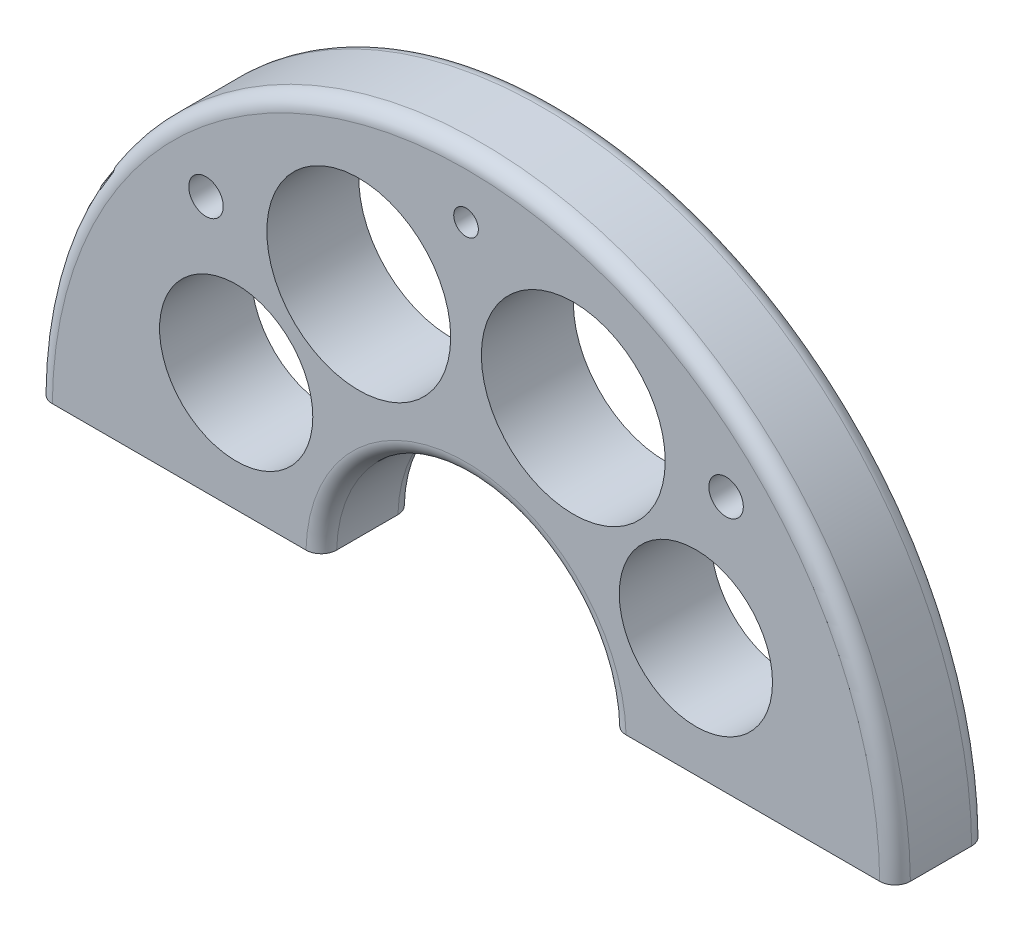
SolidWorks part; units mm, degrees
ref_plane "Front Plane" through (0, 0, 0) normal (0, 0, 1) x (1, 0, 0)
ref_plane "Top Plane" through (0, 0, 0) normal (0, 1, 0) x (1, 0, 0)
ref_plane "Right Plane" through (0, 0, 0) normal (1, 0, 0) x (0, 0, -1)
sketch "Sketch1" plane through (0, 0, 0) normal (0, 0, 1) x (1, 0, 0)
  circle A0 centre (0, 0) radius 88.9
  circle A1 centre (0, 0) radius 30
  dimension "D1" = 177.8
  dimension "D2" = 60
extrude "Boss-Extrude1" add sketch "Sketch1" along normal mid plane 19.05
hole_wizard "1/4 Clearance Hole1" positions "Sketch10" profile "Sketch11" hole size "1/4" standard "ANSI Inch"
sketch "Sketch10" plane through (0, 0, 9.525) normal (0, 0, 1) x (1, 0, 0)
  line L2 (0, 0) -> (-88.9, 0)
  line L4 (0, 0) -> (0, 88.9)
  line L6 (-88.9, 0) -> (0, 88.9)
  line L8 (0, 0) -> (-53.8815, 53.8815)
  circle A0 centre (0, 0) radius 88.9 construction
  point P13 (-53.8815, 53.8815)
  point P48 (-44.45, 44.45)
  dimension "D1" = 76.2
sketch "Sketch11" plane through (-53.8815, 53.8815, 9.525) normal (1, 0, 0) x (0, -1, 0)
  line L0 (0, 0) -> (0, 19.05)
  line L1 (0, 19.05) -> (3.5712, 19.05)
  line L2 (3.5712, 19.05) -> (3.5712, 0)
  line L5 (3.5712, 0) -> (0, 0)
  line L11 (0, -6.35) -> (0, 107.95) construction
  dimension "Thru Hole Dia." = 7.1425
  dimension "Thru Hole Depth" = 19.05
pattern_circular "CirPattern1" count 4 over 360 of "1/4 Clearance Hole1"
sketch "Sketch12" plane through (0, 0, 9.525) normal (0, 0, 1) x (1, 0, 0)
  line L0 (-88.9, 0) -> (88.9, 0)
  line L1 (-88.9, -0.7937) -> (88.9, -0.7937)
  line L2 (-88.9, 0.7937) -> (88.9, 0.7937)
  circle A0 centre (0, 0) radius 88.9 construction
  circle A2 centre (0, 0) radius 88.9
  circle A3 centre (0, 0) radius 88.9
  dimension "D1" = 0.7937
  dimension "D2" = 0.7937
  dimension "D3" = 0
extrude "Cut-Extrude1" cut sketch "Sketch12" against normal through all contours L2 L0 M9 M10 | L1 L0 M9 M10 | L2 L0 M10 M9 | L1 L0 M10 M9
ref_plane "Plane1" through (0, 88.9, 0) normal (0, 1, 0) x (1, 0, 0)
hole_wizard "CBORE for 1/4 Socket Head Cap Screw1" positions "Sketch13" profile "Sketch15" counterbore size "1/4" standard "ANSI Inch"
sketch "Sketch13" plane through (0, 88.9, 0) normal (0, 1, 0) x (1, 0, 0)
  line L8 (-88.8965, -9.525) -> (-29.9895, -9.525)
  line L9 (-88.8965, 9.525) -> (-88.8965, -9.525)
  line L10 (-29.9895, 9.525) -> (-88.8965, 9.525)
  line L11 (-29.9895, -9.525) -> (-29.9895, 9.525)
  line L12 (-88.8965, -9.525) -> (-29.9895, -9.525)
  line L13 (-88.8965, 9.525) -> (-88.8965, -9.525)
  line L14 (-29.9895, 9.525) -> (-88.8965, 9.525)
  line L15 (-29.9895, -9.525) -> (-29.9895, 9.525)
  line L16 (-88.8965, 9.525) -> (-76.2, 0)
  line L17 (-76.2, 0) -> (-88.8965, -9.525)
  line L19 (0, -55) -> (0, 55) construction
  point P0 (-76.2, 0)
  dimension "D2" = 76.2
  dimension "D1" = 0
sketch "Sketch15" plane through (-76.2, 88.9, 0) normal (1, 0, 0) x (0, 0, 1)
  line L0 (0, 0) -> (0, 90.2511)
  line L1 (0, 90.2511) -> (3.5712, 88.1052)
  line L2 (3.5712, 88.1052) -> (3.5712, 76.2)
  line L3 (3.5712, 76.2) -> (5.5562, 76.2)
  line L4 (5.5562, 76.2) -> (5.5562, 0)
  line L5 (5.5562, 0) -> (0, 0)
  line L10 (0, 90.2511) -> (-3.5712, 88.1052) construction
  line L11 (0, -6.35) -> (0, 107.95) construction
  dimension "Hole Dia." = 7.1425
  dimension "Hole Depth" = 88.1052
  dimension "C'Bore Dia." = 11.1125
  dimension "C'Bore Depth" = 76.2
  dimension "Drill Angle" = 118
hole_wizard "1/4-20 Tapped Hole1" positions "Sketch18" profile "Sketch19" tap size "1/4-20" standard "ANSI Inch"
sketch "Sketch18" plane through (0, 0.7937, 0) normal (0, -1, 0) x (-1, 0, 0)
  line L2 (-76.2, 0) -> (-29.9895, 0)
  line L3 (-29.9895, 9.525) -> (-29.9895, -9.525) construction
  line L5 (0, 55) -> (0, -55) construction
  point P0 (-76.2, 0)
  dimension "D1" = 76.2
sketch "Sketch19" plane through (76.2, 0.7937, 0) normal (1, 0, 0) x (0, 0, -1)
  line L0 (0, 0) -> (0, 36.4588)
  line L1 (0, 36.4588) -> (2.5527, 34.925)
  line L2 (2.5527, 34.925) -> (2.5527, 0)
  line L5 (2.5527, 0) -> (0, 0)
  line L10 (0, 36.4588) -> (-2.5527, 34.925) construction
  line L11 (0, -6.35) -> (0, 107.95) construction
  dimension "Tap Drill Dia." = 5.1054
  dimension "Tap Drill Depth" = 34.925
  dimension "Drill Angle" = 118
sketch "Sketch20" plane through (0, 0, -9.525) normal (0, 0, -1) x (-1, 0, 0)
  line L2 (88.8965, -0.7937) -> (29.9895, -0.7937)
  line L3 (-29.9895, -0.7937) -> (-88.8965, -0.7937)
  line L4 (88.8965, -0.7937) -> (29.9895, -0.7937)
  line L5 (-29.9895, -0.7937) -> (-88.8965, -0.7937)
  arc A2 (-88.8965, -0.7937) -> (88.8965, -0.7937) centre (0, 0) ccw
  arc A3 (-29.9895, -0.7937) -> (29.9895, -0.7937) centre (0, 0) ccw
  arc A4 (-88.8965, -0.7937) -> (88.8965, -0.7937) centre (0, 0) ccw
  arc A5 (-29.9895, -0.7937) -> (29.9895, -0.7937) centre (0, 0) ccw
  dimension "D1" = 0
extrude "Cut-Extrude2" cut sketch "Sketch20" against normal through all
fillet "Fillet1" radius 3.175
hole_wizard "1/4-20 Tapped Hole2" positions "Sketch22" profile "Sketch23" tap size "1/4-20" standard "ANSI Inch"
sketch "Sketch22" plane through (0, 0, -9.525) normal (0, 0, -1) x (-1, 0, 0)
  line L0 (0, 55) -> (0, -55) construction
  line L1 (55, 0) -> (-55, 0) construction
  point P0 (0, 76.2)
  dimension "D1" = 76.2
sketch "Sketch23" plane through (0, 76.2, -9.525) normal (1, 0, 0) x (0, 1, 0)
  line L0 (0, 0) -> (0, 19.2291)
  line L1 (0, 19.2291) -> (2.5527, 19.2291)
  line L2 (2.5527, 19.2291) -> (2.5527, 0)
  line L5 (2.5527, 0) -> (0, 0)
  line L11 (0, -6.35) -> (0, 107.95) construction
  dimension "Thru Tap Drill Dia." = 5.1054
  dimension "Thru Tap Drill Depth" = 19.2291
sketch "Sketch24" plane through (0, 0, -9.525) normal (0, 0, -1) x (-1, 0, 0)
  circle A0 centre (-47.625, 25.4) radius 15.875
  circle A1 centre (-22.225, 53.975) radius 19.05
  dimension "D1" = 38.1
  dimension "D2" = 31.75
  dimension "D3" = 47.625
  dimension "D4" = 25.4
  dimension "D5" = 53.975
  dimension "D6" = 22.225
extrude "Cut-Extrude3" cut sketch "Sketch24" against normal through all
mirror "Mirror1" about plane through (0, 0, 0) normal (1, 0, 0) of "Cut-Extrude3"
